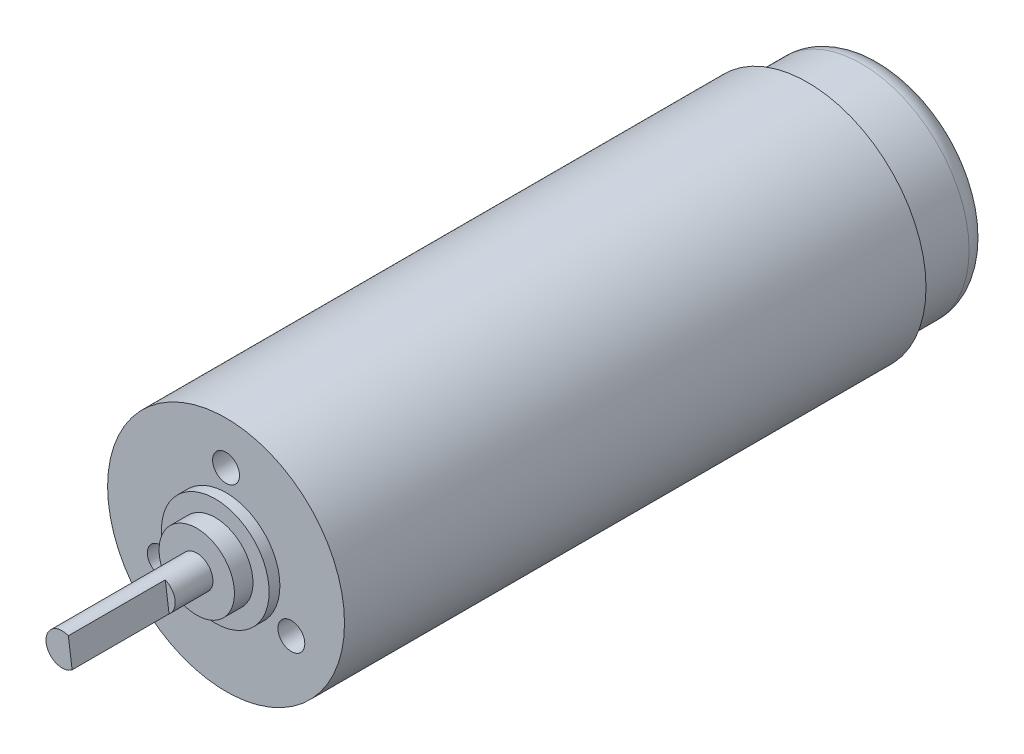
SolidWorks part; units mm, degrees
ref_plane "Front Plane" through (0, 0, 0) normal (0, 0, 1) x (1, 0, 0)
ref_plane "Top Plane" through (0, 0, 0) normal (0, 1, 0) x (1, 0, 0)
ref_plane "Right Plane" through (0, 0, 0) normal (1, 0, 0) x (0, 0, -1)
sketch "Sketch1" plane through (0, 0, 0) normal (0, 0, 1) x (1, 0, 0)
  line L0 (0, -0.0586) -> (0, 0)
  circle A0 centre (0, 0) radius 10
  dimension "D1" = 20
extrude "Boss-Extrude1" add sketch "Sketch1" along normal blind 7
sketch "Sketch2" plane through (0, 0, 7) normal (0, 0, 1) x (1, 0, 0)
  circle A0 centre (0, 0) radius 11
  dimension "D1" = 22
extrude "Boss-Extrude2" add sketch "Sketch2" along normal blind 54
sketch "Sketch3" plane through (0, 0, 61) normal (0, 0, 1) x (1, 0, 0)
  circle A0 centre (0, 0) radius 5
  dimension "D1" = 10
extrude "Boss-Extrude4" add sketch "Sketch3" along normal blind 1 contours A0
sketch "Sketch5" plane through (0, 0, 62) normal (0, 0, 1) x (1, 0, 0)
  circle A0 centre (0, 0) radius 3.5
  dimension "D1" = 7
extrude "Boss-Extrude5" add sketch "Sketch5" along normal blind 1.72 contours A0
sketch "Sketch6" plane through (0, 0, 63.72) normal (0, 0, 1) x (1, 0, 0)
  circle A0 centre (0, 0) radius 1.5
  dimension "D1" = 3
extrude "Boss-Extrude6" add sketch "Sketch6" along normal blind 12.5 contours A0
sketch "Sketch17" plane through (0, 0, 76.22) normal (0, 0, 1) x (1, 0, 0)
  line L0 (0.5756, 1.3851) -> (0.9276, -1.1788)
  circle A0 centre (0, 0) radius 1.5 construction
extrude "Cut-Extrude1" cut sketch "Sketch17" against normal blind 9 and the other way through all
sketch "Sketch18" plane through (0, 0, 61) normal (0, 0, 1) x (1, 0, 0)
  circle A0 centre (0, 7) radius 1.25
  circle A1 centre (0, 0) radius 11 construction
  dimension "D1" = 7
  dimension "D2" = 2.5
extrude "Cut-Extrude2" cut sketch "Sketch18" against normal blind 9
pattern_circular "CirPattern1" count 3 over 360 about axis through (0, 0, 0) along (0, 0, 1) of "Cut-Extrude2"
fillet "Fillet1" radius 2 1 edges at (10, 0, 0)
